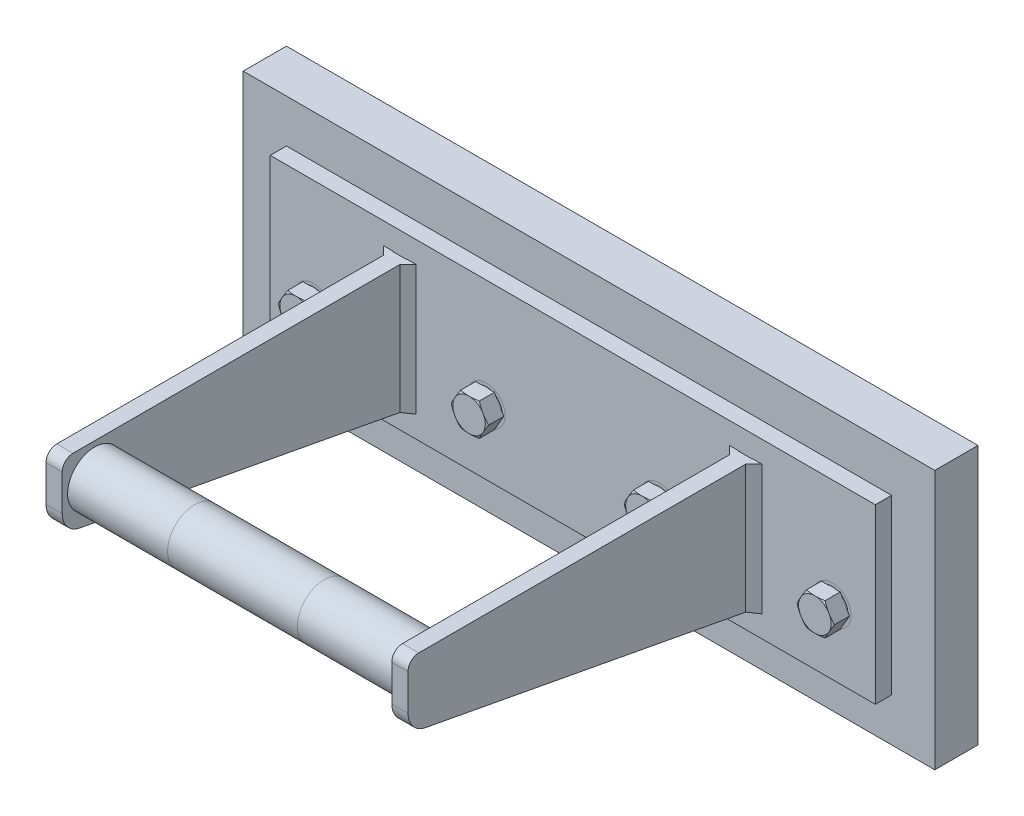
SolidWorks part; units mm, degrees
other "Exploded View1" [suppressed]
other "Explode Step1" [suppressed]
other "Explode Line1"
other "Explode Step2" [suppressed]
other "Explode Line1"
ref_plane "Front Plane" through (0, 0, 0) normal (0, 0, 1) x (1, 0, 0)
ref_plane "Top Plane" through (0, 0, 0) normal (0, 1, 0) x (1, 0, 0)
ref_plane "Right Plane" through (0, 0, 0) normal (1, 0, 0) x (0, 0, -1)
sketch "Sketch1" plane through (0, 0, 0) normal (0, 0, 1) x (1, 0, 0)
  line L1 (-177.8, 50.8) -> (177.8, 50.8)
  line L2 (-177.8, 50.8) -> (-177.8, -50.8)
  line L3 (-177.8, -50.8) -> (177.8, -50.8)
  line L4 (177.8, 50.8) -> (177.8, -50.8)
  line L5 (-177.8, 50.8) -> (177.8, -50.8) construction
  line L6 (-177.8, -50.8) -> (177.8, 50.8) construction
  point P0 (0, 0)
  dimension "D1" = 355.6
  dimension "D2" = 101.6
extrude "Boss-Extrude1" add sketch "Sketch1" along normal blind 9.525
sketch "Sketch2" plane through (0, 0, 9.525) normal (0, 0, 1) x (1, 0, 0)
  line L0 (0, 0) -> (0, 50.8) construction
  line L1 (177.8, 50.8) -> (-177.8, 50.8) construction
  line L2 (0, 0) -> (101.6, 0) construction
  line L3 (-96.8375, -38.1) -> (-106.3625, 38.1) construction
  line L4 (96.8375, 38.1) -> (106.3625, 38.1)
  line L5 (96.8375, 38.1) -> (96.8375, -38.1)
  line L6 (96.8375, -38.1) -> (106.3625, -38.1)
  line L7 (106.3625, 38.1) -> (106.3625, -38.1)
  line L8 (96.8375, 38.1) -> (106.3625, -38.1) construction
  line L9 (96.8375, -38.1) -> (106.3625, 38.1) construction
  line L10 (-96.8375, 38.1) -> (-106.3625, -38.1) construction
  line L11 (-106.3625, 38.1) -> (-106.3625, -38.1)
  line L12 (-96.8375, -38.1) -> (-106.3625, -38.1)
  line L13 (-96.8375, 38.1) -> (-96.8375, -38.1)
  line L14 (-96.8375, 38.1) -> (-106.3625, 38.1)
  dimension "D1" = 9.525
  dimension "D2" = 76.2
  dimension "D3" = 101.6
extrude "Boss-Extrude2" add sketch "Sketch2" along normal blind 203.2
sketch "Sketch3" plane through (106.3625, 0, 0) normal (1, 0, 0) x (0, 0, -1)
  line L0 (-9.525, -38.1) -> (-212.725, 0)
  line L1 (-212.725, -38.1) -> (-212.725, 38.1) construction
  line L2 (-212.725, 0) -> (-212.725, -38.1)
  line L3 (-212.725, -38.1) -> (-9.525, -38.1)
  line L4 (-212.725, 38.1) -> (-9.525, 38.1) construction
  dimension "D1" = 38.1
extrude "Cut-Extrude1" cut sketch "Sketch3" against normal through all
fillet "Fillet1" radius 12.7
sketch "Sketch4" plane through (-96.8375, 0, 0) normal (1, 0, 0) x (0, 0, -1)
  line L0 (-193.675, 38.1) -> (-193.675, 19.05) construction
  line L1 (-212.725, 38.1) -> (-9.525, 38.1) construction
  line L2 (-212.725, 10.5401) -> (-212.725, 38.1) construction
  circle A0 centre (-193.675, 19.05) radius 15.875
  dimension "D1" = 31.75
  dimension "D2" = 19.05
  dimension "D3" = 19.05
extrude "Boss-Extrude3" add sketch "Sketch4" along normal up to surface (193.675 mm away)
sketch "Sketch8" plane through (0, 38.1, 0) normal (0, 1, 0) x (1, 0, 0)
  line L0 (-96.8375, -9.525) -> (-106.3625, -9.525) construction
  line L1 (-105.6005, -9.525) -> (-97.5995, -9.525)
  line L2 (-105.6005, -9.525) -> (-105.6005, -9.779)
  line L3 (-105.6005, -9.779) -> (-97.5995, -9.779)
  line L4 (-97.5995, -9.525) -> (-97.5995, -9.779)
  line L5 (-96.8375, -212.725) -> (-96.8375, -9.525) construction
  line L6 (-106.3625, -212.725) -> (-106.3625, -9.525) construction
  line L7 (-96.8375, -9.525) -> (96.8375, -9.525) construction
  line L8 (0, -9.525) -> (0, -21.7695) construction
  line L9 (97.5995, -9.525) -> (97.5995, -9.779)
  line L10 (105.6005, -9.779) -> (97.5995, -9.779)
  line L11 (105.6005, -9.525) -> (105.6005, -9.779)
  line L12 (105.6005, -9.525) -> (97.5995, -9.525)
  dimension "D1" = 0.762
  dimension "D2" = 0.762
  dimension "D3" = 0.254
extrude "Cut-Extrude3" cut sketch "Sketch8" against normal through all
chamfer "Chamfer1" distance 4.7752 angle 45
sketch "Sketch5" plane through (0, 0, 0) normal (0, 1, 0) x (1, 0, 0)
  line L1 (-38.1, 271.3992) -> (38.1, 271.3992)
  line L2 (-38.1, 271.3992) -> (-38.1, -271.3992)
  line L3 (-38.1, -271.3992) -> (38.1, -271.3992)
  line L4 (38.1, 271.3992) -> (38.1, -271.3992)
  line L5 (-38.1, 271.3992) -> (38.1, -271.3992) construction
  line L6 (-38.1, -271.3992) -> (38.1, 271.3992) construction
  point P0 (0, 0)
  dimension "D1" = 76.2
  dimension "D2" = 542.7983
sketch "Sketch6" plane through (0, 0, 9.525) normal (0, 0, 1) x (1, 0, 0)
  line L0 (0, -12.7) -> (50.8, -12.7) construction
  line L1 (50.8, -12.7) -> (152.4, -12.7) construction
  line L2 (0, -12.7) -> (0, -50.8) construction
  line L3 (-177.8, -50.8) -> (177.8, -50.8) construction
  line L4 (0, 0) -> (-8.1041, 0) construction
  circle A0 centre (50.8, -12.7) radius 6.7469
  circle A1 centre (152.4, -12.7) radius 6.7469
  circle A2 centre (-152.4, -12.7) radius 6.7469
  circle A3 centre (-50.8, -12.7) radius 6.7469
  dimension "D1" = 13.4937
  dimension "D2" = 13.4937
  dimension "D3" = 50.8
  dimension "D4" = 101.6
  dimension "D5" = 12.7
extrude "Cut-Extrude2" cut sketch "Sketch6" against normal blind 50.8
fillet "Fillet2" radius 6.35
ref_plane "Plane1" [suppressed] through (0, 0, 0) normal (0, 0, -1) x (-1, 0, 0)
sketch "Sketch7" plane through (0, 0, 0) normal (0, 0, -1) x (-1, 0, 0)
  line L1 (-203.2, 76.2) -> (203.2, 76.2)
  line L2 (-203.2, 76.2) -> (-203.2, -76.2)
  line L3 (-203.2, -76.2) -> (203.2, -76.2)
  line L4 (203.2, 76.2) -> (203.2, -76.2)
  line L5 (-203.2, 76.2) -> (203.2, -76.2) construction
  line L6 (-203.2, -76.2) -> (203.2, 76.2) construction
  circle A0 centre (-152.4, -12.7) radius 6.7469 construction
  circle A1 centre (-50.8, -12.7) radius 6.7469 construction
  circle A2 centre (50.8, -12.7) radius 6.7469 construction
  circle A3 centre (152.4, -12.7) radius 6.7469 construction
  circle A4 centre (-152.4, -12.7) radius 6.7469
  circle A5 centre (-50.8, -12.7) radius 6.7469
  circle A6 centre (50.8, -12.7) radius 6.7469
  circle A7 centre (152.4, -12.7) radius 6.7469
  point P12 (0, 0)
  dimension "D1" = 406.4
  dimension "D2" = 152.4
extrude "Boss-Extrude4" add sketch "Sketch7" along normal blind 25.4 separate body
sketch "Sketch9" plane through (0, 0, 9.525) normal (0, 0, 1) x (1, 0, 0)
  line L7 (163.3985, -12.7) -> (157.8993, -3.175) construction
  line L8 (157.8993, -3.175) -> (146.9007, -3.175) construction
  line L9 (146.9007, -3.175) -> (141.4015, -12.7) construction
  line L10 (141.4015, -12.7) -> (146.9007, -22.225) construction
  line L11 (146.9007, -22.225) -> (157.8993, -22.225) construction
  line L12 (157.8993, -22.225) -> (163.3985, -12.7) construction
  circle A0 centre (152.4, -12.7) radius 9.271
  circle A1 centre (152.4, -12.7) radius 9.525 construction
  dimension "D1" = 18.542
  dimension "D2" = 19.05
extrude "Boss-Extrude5" add sketch "Sketch9" along normal blind 10.16 separate body
sketch "Sketch11" plane through (0, 0, 19.685) normal (0, 0, 1) x (1, 0, 0)
  line L1 (163.3985, -12.7) -> (157.8993, -3.175)
  line L2 (157.8993, -3.175) -> (146.9007, -3.175)
  line L3 (146.9007, -3.175) -> (141.4015, -12.7)
  line L4 (141.4015, -12.7) -> (146.9007, -22.225)
  line L5 (146.9007, -22.225) -> (157.8993, -22.225)
  line L6 (157.8993, -22.225) -> (163.3985, -12.7)
  circle A0 centre (152.4, -12.7) radius 9.525 construction
  dimension "D1" = 19.05
extrude "Boss-Extrude6" add sketch "Sketch11" against normal blind 9.398
sketch "Sketch12" plane through (0, 0, 9.525) normal (0, 0, -1) x (-1, 0, 0)
  circle A0 centre (-152.4, -12.7) radius 6.3246
  circle A1 centre (-152.4, -12.7) radius 9.271 construction
  dimension "D1" = 12.6492
extrude "Boss-Extrude7" add sketch "Sketch12" along normal blind 50.8
ref_plane "Plane2" through (119.7993, -69.1661, 0) normal (0.866, -0.5, 0) x (0, 0, -1)
sketch "Sketch13" plane through (119.7993, -69.1661, 0) normal (0.866, -0.5, 0) x (0, 0, -1)
  line L0 (-9.525, 58.8769) -> (-9.525, 71.5261) construction
  line L1 (-9.525, 58.8769) -> (-9.525, 71.5261) construction
  line L2 (-9.525, 65.2015) -> (-21.336, 65.2015) construction
  line L3 (-19.685, 76.2) -> (-19.685, 54.203)
  line L4 (-19.685, 76.2) -> (-19.685, 54.203) construction
  line L5 (-21.336, 65.2015) -> (-24.0013, 65.2015)
  line L6 (-24.0013, 65.2015) -> (-24.0013, 82.9815)
  line L7 (-24.0013, 82.9815) -> (-15.0952, 82.9815)
  arc A0 (-15.0952, 82.9815) -> (-21.336, 65.2015) centre (7.112, 65.2015) ccw
  dimension "D2" = 28.448
  dimension "D1" = 1.651
  dimension "D3" = 17.78
  dimension "D4" = 2.6653
revolve "Cut-Revolve1" cut sketch "Sketch13" angle 360 about L5
chamfer "Chamfer2" distance 1.016 angle 45
sketch "Sketch14" plane through (0, 0, -25.4) normal (0, 0, -1) x (-1, 0, 0)
  line L1 (-152.4, -23.6985) -> (-142.875, -18.1993)
  line L2 (-142.875, -18.1993) -> (-142.875, -7.2007)
  line L3 (-142.875, -7.2007) -> (-152.4, -1.7015)
  line L4 (-152.4, -1.7015) -> (-161.925, -7.2007)
  line L5 (-161.925, -7.2007) -> (-161.925, -18.1993)
  line L6 (-161.925, -18.1993) -> (-152.4, -23.6985)
  circle A3 centre (-152.4, -12.7) radius 6.3246 construction
  circle A4 centre (-152.4, -12.7) radius 6.3246 construction
  circle A5 centre (-152.4, -12.7) radius 9.525 construction
  circle A6 centre (-152.4, -12.7) radius 6.3754
  dimension "D1" = 19.05
  dimension "D2" = 0.0508
extrude "Boss-Extrude8" add sketch "Sketch14" along normal blind 8.89 separate body
sketch "Sketch15" plane through (119.7993, -69.1661, 0) normal (0.866, -0.5, 0) x (0, 0, -1)
  line L0 (34.29, 55.6765) -> (34.29, 58.8261)
  line L1 (34.29, 71.5769) -> (34.29, 74.7265)
  line L2 (34.29, 71.5769) -> (34.29, 74.7265) construction
  line L3 (34.29, 71.5769) -> (34.29, 74.7265) construction
  line L4 (34.29, 71.5769) -> (34.29, 58.8261) construction
  line L5 (34.29, 65.2015) -> (16.256, 65.2015) construction
  line L6 (32.1183, 52.5015) -> (38.1, 52.5015)
  line L7 (38.1, 52.5015) -> (38.1, 58.8769)
  line L8 (38.1, 58.8769) -> (35.5667, 58.8769)
  line L9 (-9.525, 58.8769) -> (40.259, 58.8769) construction
  line L10 (34.29, 55.6765) -> (25.4, 55.6765) construction
  line L11 (34.29, 55.6765) -> (25.4, 55.6765) construction
  line L12 (29.845, 55.6765) -> (29.845, 60.6818) construction
  line L13 (21.59, 52.5015) -> (21.59, 58.8769)
  line L14 (27.5717, 52.5015) -> (21.59, 52.5015)
  line L15 (21.59, 58.8769) -> (24.1233, 58.8769)
  line L16 (34.29, 55.6765) -> (34.29, 58.8261) construction
  arc A0 (35.5667, 58.8769) -> (32.1183, 52.5015) centre (16.256, 65.2015) cw
  arc A1 (24.1233, 58.8769) -> (27.5717, 52.5015) centre (43.434, 65.2015) ccw
  dimension "D1" = 20.32
  dimension "D2" = 18.034
  dimension "D3" = 3.81
  dimension "D4" = 12.7
revolve "Cut-Revolve3" cut sketch "Sketch15" angle 360 about L5
fillet "Fillet4" radius 0.381
pattern_linear "LPattern1" count 4 spacing 101.6
sketch "Sketch16" plane through (0, 0, 9.525) normal (0, 0, 1) x (1, 0, 0)
  circle A2 centre (152.4, -12.7) radius 11.0649
  circle A3 centre (152.4, -12.7) radius 11.0649
  circle A4 centre (50.8, -12.7) radius 11.0649
  circle A5 centre (50.8, -12.7) radius 11.0649
  circle A7 centre (-50.8, -12.7) radius 11.0649
  circle A8 centre (-50.8, -12.7) radius 11.0649
  circle A10 centre (-152.4, -12.7) radius 11.0649
  circle A11 centre (-152.4, -12.7) radius 11.0649
  dimension "D1" = 4.318
  dimension "D2" = 4.318
  dimension "D3" = 4.318
  dimension "D4" = 4.318
move or copy body "Body-Move/Copy1" [suppressed] bodies to move or copy 118 copy no translate (0, 0, 62.1604)
move or copy body "Body-Move/Copy2" [suppressed] bodies to move or copy 120 copy no translate (0, 0, -30.48)
